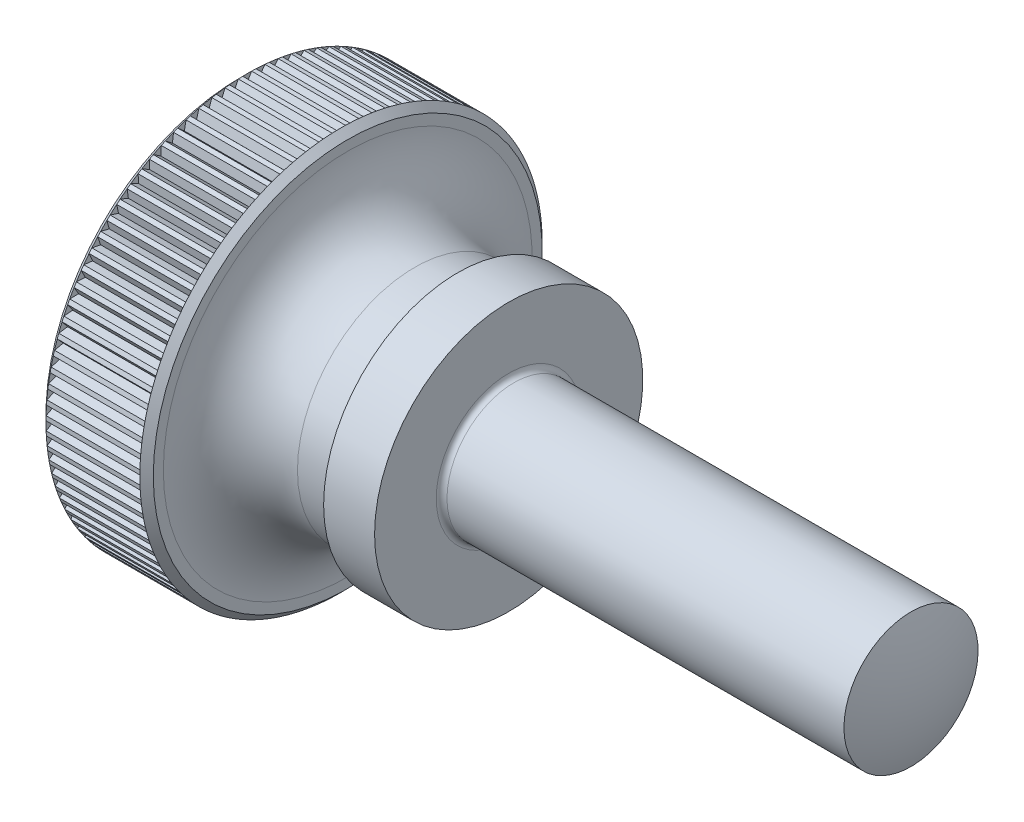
SolidWorks part; units mm, degrees
ref_plane "Front" through (0, 0, 0) normal (0, 0, 1) x (1, 0, 0)
ref_plane "Top" through (0, 0, 0) normal (0, 1, 0) x (1, 0, 0)
ref_plane "Right" through (0, 0, 0) normal (1, 0, 0) x (0, 0, -1)
sketch "Sketch1" plane through (0, 0, 0) normal (0, 0, 1) x (1, 0, 0)
  line L0 (0, 0) -> (0, 15)
  line L1 (0, 15) -> (8, 15)
  line L2 (8, 15) -> (8, 8.75)
  line L3 (8, 8.75) -> (16.2, 8.75)
  line L4 (16.2, 8.75) -> (16.2, 10)
  line L5 (16.2, 10) -> (20, 10)
  line L6 (20, 10) -> (20, 5)
  line L7 (20, 5) -> (50, 5)
  line L8 (0, 0) -> (50.9233, 0)
  line L9 (-48.2111, 0) -> (101.1311, 0) construction
  arc A0 (50.9233, 0) -> (50, 5) centre (36.9233, 0) ccw
  dimension "re" = 14
  dimension "dk" = 30
  dimension "d" = 10
  dimension "d1" = 20
  dimension "k1" = 8
  dimension "k2" = 3.8
  dimension "k" = 20
  dimension "l" = 30
  dimension "d2" = 17.5
revolve "Base" add sketch "Sketch1" angle 360 about L9
fillet "Fillet1" radius 5 1 edges at (8, 0, 8.75)
chamfer "Chamfer1" distance 0.5 angle 45 2 edges at (8, 0, 15) (0, 0, 15)
ref_plane "Plane1" through (0.5, 0, 0) normal (-1, 0, 0) x (0, 0, 1)
sketch "Sketch2" plane through (0.5, 0, 0) normal (1, 0, 0) x (0, 0, -1)
  line L1 (0, 14.4226) -> (0.5, 15.2887)
  line L2 (0.5, 15.2887) -> (-0.5, 15.2887)
  line L3 (-0.5, 15.2887) -> (0, 14.4226)
  circle A1 centre (0, 0) radius 15 construction
  circle A2 centre (0, 15) radius 0.2887 construction
  dimension "D1" = 1
extrude "Cut-Extrude1" cut sketch "Sketch2" along normal blind 7
pattern_circular "Circular-Pattern1" count 95 over 360 about axis through (0, 0, 0) along (1, 0, 0) of "Cut-Extrude1"
fillet "Fillet2" radius 0.4 1 edges at (20, 0, 5)
sketch "Sketch3" plane through (0, 0, 0) normal (0, 0, 1) x (1, 0, 0)
  line L0 (20.4, 6.25) -> (21.65, 6.25)
  line L1 (21.65, 6.25) -> (21.65, 5)
  line L2 (21.65, 5) -> (21.025, 3.9175)
  line L3 (21.025, 3.9175) -> (20.4, 5)
  line L4 (20.4, 5) -> (20.4, 6.25)
  line L5 (20.4, -5) -> (20.4, 5) construction
  line L6 (50, 5) -> (20.4, 5) construction
  dimension "D1" = 1.25
revolve "Cut-Revolve10" [suppressed] cut sketch "Sketch3" angle 360 about axis through (-48.2111, 0, 0) along (1, 0, 0)
pattern_linear "LPattern10" [suppressed] count 20 along (1, 0, 0)
equation "\"D1@Circular-Pattern1\" =int (  \"dk@Sketch1\" * PI+1 )"
equation "\"D1@ThreadCosmetic1\" = \"l@Sketch1\""
equation "\"D1@Plane1\" = \"c@Chamfer1\""
equation "\"D1@Cut-Extrude1\" =\"k1@Sketch1\" - 2 * \"c@Chamfer1\""
equation "\"D1@Sketch3\" =  ( \"d@Sketch1\" - \"THD_MINOR@ThreadCosmetic1\" )  / 2"
equation "\"pitch@LPattern10\" = 1.2 * \"D1@Sketch3\""
equation "\"D1@LPattern10\" = \"D1@ThreadCosmetic1\" / \"pitch@LPattern10\""
